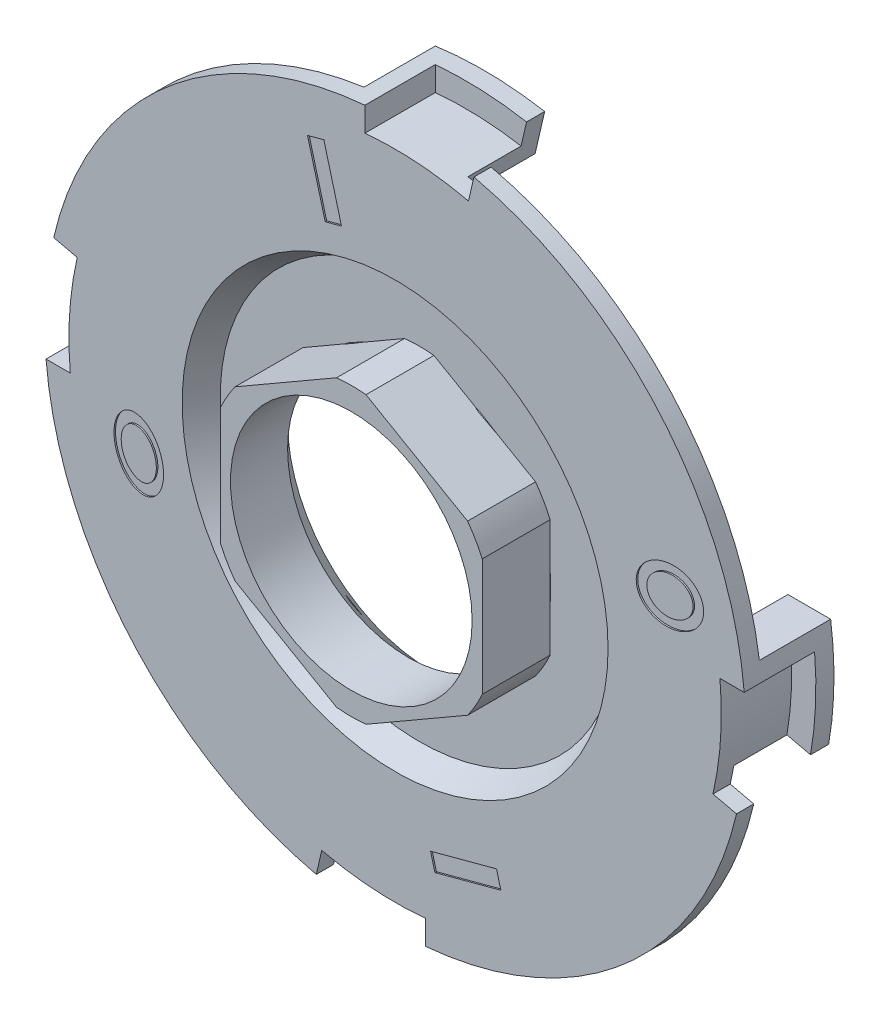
SolidWorks part; units mm, degrees
ref_plane "Front" through (0, 0, 0) normal (0, 0, 1) x (1, 0, 0)
ref_plane "Top" through (0, 0, 0) normal (0, 1, 0) x (1, 0, 0)
ref_plane "Right" through (0, 0, 0) normal (1, 0, 0) x (0, 0, -1)
sketch "Sketch1" plane through (0, 0, 0) normal (0, 0, 1) x (1, 0, 0)
  circle A0 centre (0, 0) radius 29.464
  dimension "D1" = 58.928
extrude "Base-Extrude" add sketch "Sketch1" against normal blind 1.4478
sketch "Sketch2" plane through (0, 0, -1.4478) normal (0, 0, -1) x (-1, 0, 0)
  circle A0 centre (0, 0) radius 18.5674
  dimension "D1" = 37.1348
extrude "Boss-Extrude1" add sketch "Sketch2" along normal blind 1.5748
fillet "Fillet1" radius 1.5748 1 edges at (-18.5674, 0, -3.0226)
sketch "Sketch3" plane through (0, 0, 0) normal (0, 0, 1) x (1, 0, 0)
  circle A0 centre (0, 0) radius 17.907
  dimension "D1" = 35.814
extrude "Cut-Extrude1" cut sketch "Sketch3" against normal blind 2.032 draft 30
sketch "Sketch4" plane through (0, 0, -2.032) normal (0, 0, 1) x (1, 0, 0)
  line L1 (0, 12.7143) -> (-11.0109, 6.3571)
  line L2 (-11.0109, 6.3571) -> (-11.0109, -6.3571)
  line L3 (-11.0109, -6.3571) -> (0, -12.7143)
  line L4 (0, -12.7143) -> (11.0109, -6.3571)
  line L5 (11.0109, -6.3571) -> (11.0109, 6.3571)
  line L6 (11.0109, 6.3571) -> (0, 12.7143)
  line L7 (0, 0) -> (0, 32.6189) construction
  circle A0 centre (0, 0) radius 11.0109 construction
  dimension "D1" = 22.0218
extrude "Boss-Extrude2" add sketch "Sketch4" along normal blind 5.715
sketch "Sketch5" plane through (0, 0, 3.683) normal (0, 0, 1) x (1, 0, 0)
  line L0 (0, 12.7143) -> (-11.0109, 6.3571) construction
  line L1 (11.0109, 6.3571) -> (0, 12.7143) construction
  line L2 (11.0109, -6.3571) -> (11.0109, 6.3571) construction
  line L3 (0, -12.7143) -> (11.0109, -6.3571) construction
  line L4 (-11.0109, -6.3571) -> (0, -12.7143) construction
  line L5 (-11.0109, 6.3571) -> (-11.0109, -6.3571) construction
  line L6 (0, 12.7143) -> (-1.2342, 12.0017)
  line L7 (11.0109, 6.3571) -> (9.7767, 7.0697)
  line L8 (11.0109, -6.3571) -> (11.0109, -4.932)
  line L9 (0, -12.7143) -> (1.2342, -12.0017)
  line L10 (-11.0109, -6.3571) -> (-9.7767, -7.0697)
  line L11 (-11.0109, 6.3571) -> (-11.0109, 4.932)
  line L12 (-9.7767, 7.0697) -> (-11.0109, 6.3571)
  line L13 (-11.0109, -4.932) -> (-11.0109, -6.3571)
  line L14 (-1.2342, -12.0017) -> (0, -12.7143)
  line L15 (9.7767, -7.0697) -> (11.0109, -6.3571)
  line L16 (11.0109, 4.932) -> (11.0109, 6.3571)
  line L17 (1.2342, 12.0017) -> (0, 12.7143)
  arc A0 (-9.7767, 7.0697) -> (-11.0109, 4.932) centre (0, 0) ccw
  arc A1 (-11.0109, -4.932) -> (-9.7767, -7.0697) centre (0, 0) ccw
  arc A2 (-1.2342, -12.0017) -> (1.2342, -12.0017) centre (0, 0) ccw
  arc A3 (9.7767, -7.0697) -> (11.0109, -4.932) centre (0, 0) ccw
  arc A4 (11.0109, 4.932) -> (9.7767, 7.0697) centre (0, 0) ccw
  arc A5 (1.2342, 12.0017) -> (-1.2342, 12.0017) centre (0, 0) ccw
  dimension "D1" = 24.13
extrude "Cut-Extrude2" cut sketch "Sketch5" against normal up to surface (5.715 mm away)
sketch "Sketch6" plane through (0, 0, 3.683) normal (0, 0, 1) x (1, 0, 0)
  circle A0 centre (0, 0) radius 10.16
  dimension "D1" = 20.32
extrude "Cut-Extrude3" cut sketch "Sketch6" against normal through all
sketch "Sketch8" plane through (0, 0, -1.4478) normal (0, 0, -1) x (-1, 0, 0)
  line L0 (0, 0) -> (0, 32.872) construction
  line L1 (2.54, 29.3543) -> (2.54, 27.3142)
  line L2 (0, 0) -> (-7.3756, 31.9471) construction
  line L3 (-6.628, 28.7088) -> (-6.1709, 26.7289)
  circle A0 centre (0, 0) radius 29.464 construction
  arc A1 (2.54, 27.3142) -> (-6.1709, 26.7289) centre (0, 0) ccw
  arc A2 (2.54, 29.3543) -> (-6.628, 28.7088) centre (0, 0) ccw
  dimension "D2" = 54.864
  dimension "D1" = 2.54
  dimension "D3" = 13
extrude "Cut-Extrude4" cut sketch "Sketch8" against normal through all
pattern_circular "CirPattern1" count 4 over 360 about axis through (0, 0, 0) along (0, 0, 1) of "Cut-Extrude4"
sketch "Sketch9" plane through (0, 0, -1.4478) normal (0, 0, -1) x (-1, 0, 0)
  line L2 (4.064, 25.5873) -> (4.064, 29.3543)
  line L3 (4.064, 25.5873) -> (4.064, 29.1824)
  line L6 (-5.143, 29.0517) -> (-4.6859, 27.0717)
  line L7 (-5.1341, 29.0132) -> (-4.333, 25.5431)
  arc A2 (4.064, 25.5873) -> (-5.828, 25.244) centre (0, 0) ccw
  arc A3 (4.064, 25.5873) -> (-4.333, 25.5431) centre (0, 0) ccw
  arc A4 (28.7088, 6.628) -> (2.54, 29.3543) centre (0, 0) ccw construction
  arc A6 (4.064, 29.1824) -> (-5.1341, 29.0132) centre (0, 0) ccw
  dimension "D1" = 1.524
  dimension "D2" = 1.524
extrude "Boss-Extrude3" add sketch "Sketch9" along normal blind 5.9944
sketch "Sketch10" plane through (0, 0, -1.4478) normal (0, 0, 1) x (1, 0, 0)
  line L0 (5.1341, 29.0132) -> (4.6764, 27.0305) construction
  line L1 (-2.54, 29.3543) -> (-2.54, 27.3142) construction
  line L2 (5.1341, 29.0132) -> (4.6764, 27.0305)
  line L3 (-2.54, 29.3543) -> (-2.54, 27.3142)
  arc A0 (5.1341, 29.0132) -> (-2.54, 29.3543) centre (0, 0) ccw construction
  arc A1 (6.1709, 26.7289) -> (-2.54, 27.3142) centre (0, 0) ccw construction
  arc A2 (5.1341, 29.0132) -> (-2.54, 29.3543) centre (0, 0) ccw
  arc A3 (4.6764, 27.0305) -> (-2.54, 27.3142) centre (0, 0) ccw
extrude "Cut-Extrude5" cut sketch "Sketch10" against normal blind 4.4704
pattern_circular "CirPattern2" count 4 over 360 about axis through (0, 0, 0) along (0, 0, 1) of "Cut-Extrude5", "Boss-Extrude3"
sketch "Sketch11" plane through (0, 0, 0) normal (0, 0, 1) x (1, 0, 0)
  line L0 (0, 0) -> (-8.5138, 31.774) construction
  line L1 (0, 0) -> (0, 31.7749) construction
  line L2 (-7.3662, 24.743) -> (-5.8804, 19.1982)
  line L3 (-5.9922, 25.1111) -> (-4.5065, 19.5663)
  line L4 (-7.3662, 24.743) -> (-5.9922, 25.1111)
  line L5 (-5.8804, 19.1982) -> (-4.5065, 19.5663)
  circle A0 centre (0, 0) radius 17.907 construction
  dimension "D1" = 15
  dimension "D2" = 0.7112
  dimension "D3" = 1.4224
  dimension "D4" = 2.159
  dimension "D5" = 5.7404
extrude "Cut-Extrude6" cut sketch "Sketch11" against normal blind 0.127
sketch "Sketch12" plane through (0, 0, 0) normal (0, 0, 1) x (1, 0, 0)
  line L0 (5.7162, -21.333) -> (-5.9363, 22.1547) construction
  line L2 (-3.5163, -24.6875) -> (20.5437, -18.2406) construction
  line L3 (2.9799, -22.2106) -> (8.5247, -20.7248)
  line L4 (3.348, -23.5845) -> (8.8928, -22.0988)
  line L5 (2.9799, -22.2106) -> (3.348, -23.5845)
  line L6 (8.5247, -20.7248) -> (8.8928, -22.0988)
  line L7 (-6.6233, 21.9706) -> (-5.2494, 22.3387) construction
  line L8 (-7.3662, 24.743) -> (-5.8804, 19.1982) construction
  line L9 (-4.5065, 19.5663) -> (-5.9922, 25.1111) construction
  circle A0 centre (0, 0) radius 22.9362 construction
  dimension "D1" = 0.7112
  dimension "D2" = 1.4224
  dimension "D3" = 2.8702
  dimension "D4" = 5.7404
extrude "Cut-Extrude7" cut sketch "Sketch12" against normal blind 0.127
sketch "Sketch13" plane through (0, 0, 0) normal (0, 0, 1) x (1, 0, 0)
  line L0 (-21.5549, -5.5171) -> (23.1103, 6.4509) construction
  line L1 (5.7162, -21.333) -> (-5.9363, 22.1547) construction
  ellipse E0 centre (23.1103, 6.4509) end of major axis (20.3379, 5.708) minor radius 2.3159
  ellipse E1 centre (23.1103, 6.4509) end of major axis (21.2104, 5.9418) minor radius 1.5742
  ellipse E2 centre (-21.5549, -5.5171) end of major axis (-20.812, -8.2895) minor radius 2.0151
  ellipse E3 centre (-21.5549, -5.5171) end of major axis (-21.0458, -7.4171) minor radius 1.4362
extrude "Cut-Extrude8" cut sketch "Sketch13" against normal blind 0.127
chamfer "Chamfer1" distance 1.905 angle 45 1 edges at (10.16, 0, -3.0226)
